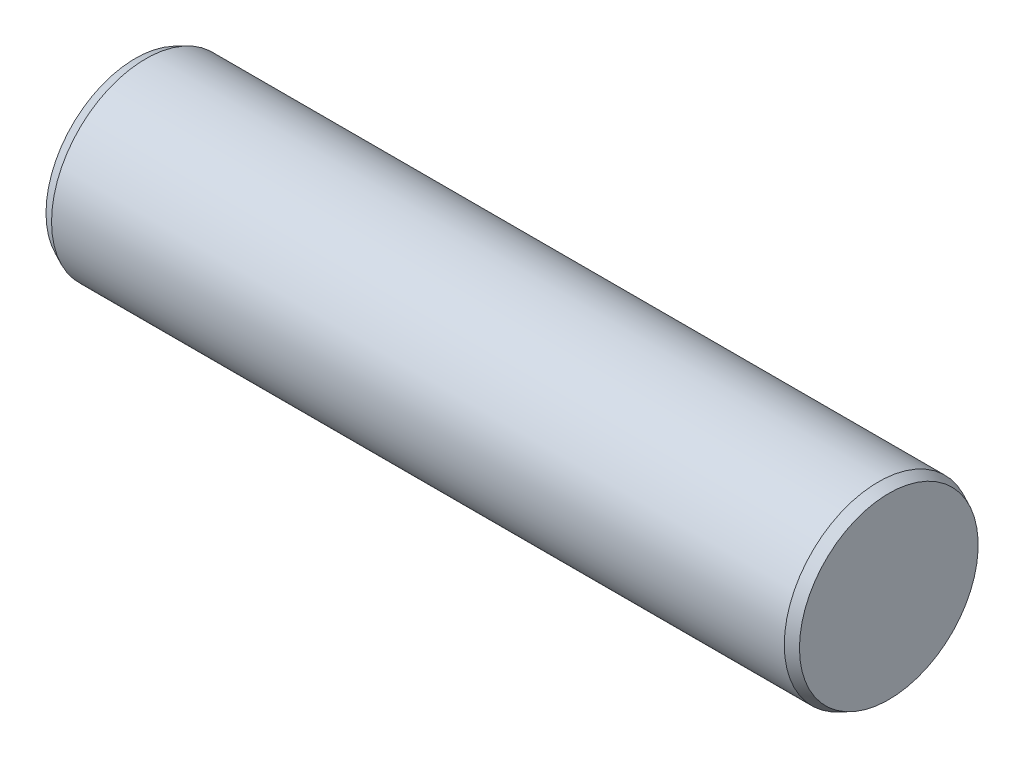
SolidWorks part; units mm, degrees
ref_plane "Plane1" through (0, 0, 0) normal (0, 0, 1) x (1, 0, 0)
ref_plane "Plane2" through (0, 0, 0) normal (0, 1, 0) x (1, 0, 0)
ref_plane "Plane3" through (0, 0, 0) normal (1, 0, 0) x (0, 0, -1)
sketch "Sketch1" plane through (0, 0, 0) normal (0, 0, 1) x (1, 0, 0)
  line L1 (-6.35, 0) -> (107.95, 0) construction
  line L2 (0, 0) -> (101.6, 0)
  line L3 (101.6, 0) -> (101.6, 12.0486)
  line L4 (101.6, 12.0486) -> (100.203, 12.7)
  line L5 (100.203, 12.7) -> (1.397, 12.7)
  line L6 (0, 12.0486) -> (0, 0)
  line L7 (1.397, 12.7) -> (0, 12.0486)
  dimension "D1" = 25
  dimension "D2" = 1.397
  dimension "D3" = 25
  dimension "Diameter" = 25.4
  dimension "Length" = 101.6
  dimension "Chamfer_length" = 1.397
revolve "Base-Revolve" add sketch "Sketch1" angle 360 about L1
equation "\"D2@Sketch1\" = \"Chamfer_length@Sketch1\""
